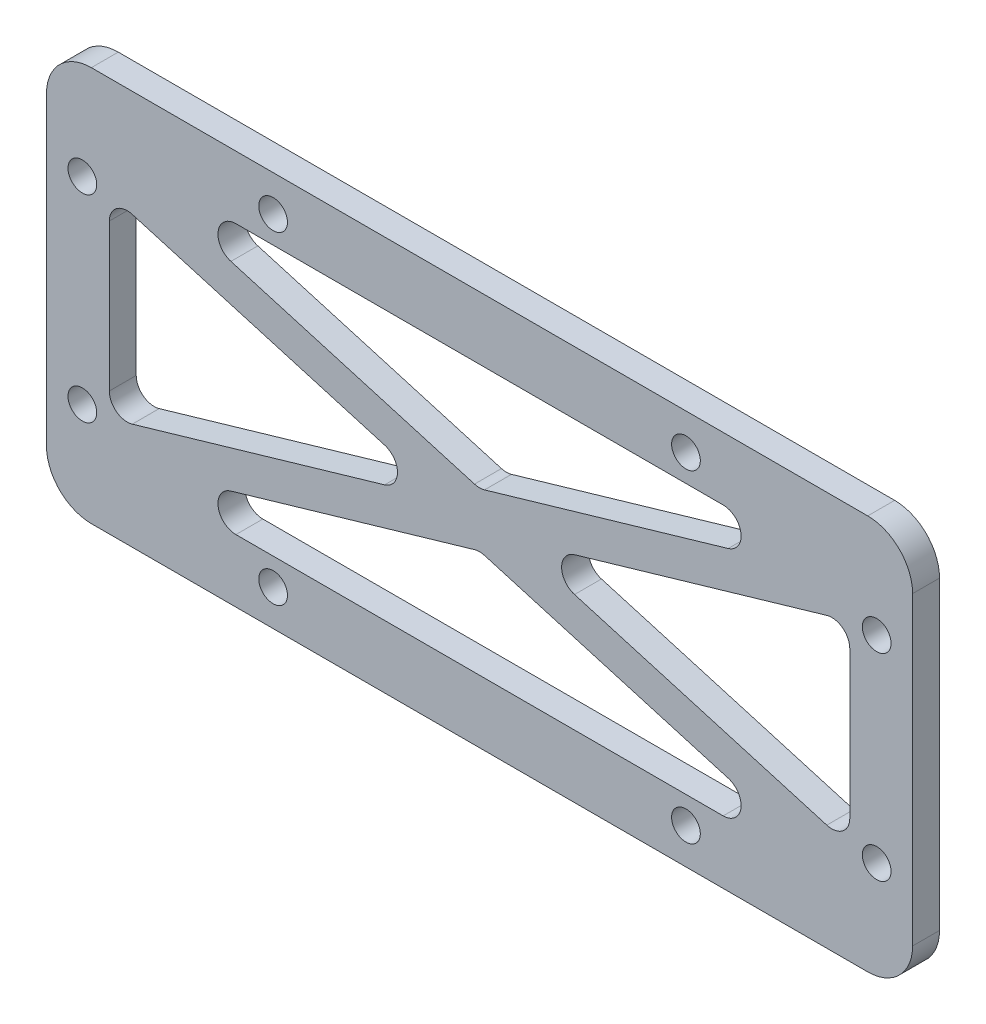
SolidWorks part; units mm, degrees
ref_plane "前视基准面" through (0, 0, 0) normal (0, 0, 1) x (1, 0, 0)
ref_plane "上视基准面" through (0, 0, 0) normal (0, 1, 0) x (1, 0, 0)
ref_plane "右视基准面" through (0, 0, 0) normal (1, 0, 0) x (0, 0, -1)
sketch "草图1" plane through (0, 0, 0) normal (0, 0, 1) x (1, 0, 0)
  line L0 (27.1114, 11.2135) -> (-27.1114, 11.2135)
  line L1 (-2.6024, -11.2135) -> (2.6024, -11.2135)
  line L3 (-48.2508, -22) -> (48.2508, -22)
  line L4 (-48.2508, -22) -> (-48.2508, 22)
  line L5 (-48.2508, 22) -> (48.2508, 22)
  line L6 (48.2508, -22) -> (48.2508, 22)
  line L7 (-48.2508, -22) -> (48.2508, 22) construction
  line L8 (-48.2508, 22) -> (48.2508, -22) construction
  arc A0 (-39.034, 5.5252) -> (-37.1301, -9.2259) centre (-36.2508, -1.614) ccw
  arc A1 (-37.1301, -9.2259) -> (-2.6024, -11.2135) centre (-2.6024, 289.6827) ccw
  arc A2 (2.6024, -11.2135) -> (37.1301, -9.2259) centre (2.6024, 289.6827) ccw
  arc A3 (37.1301, -9.2259) -> (39.034, 5.5252) centre (36.2508, -1.614) ccw
  parabola Q0
  spline S0 degree 3 poles (-31.8155, 7.781) (-32.3574, 7.3189) (-32.9593, 7.044) (-33.6058, 6.8537) knots 0.815552 0.815552 0.815552 0.815552 0.891439 0.891439 0.891439 0.891439
  spline S1 degree 3 poles (-33.6058, 6.8537) (-34.5724, 6.5693) (-36.3536, 6.4101) (-38.2708, 5.8228) (-39.034, 5.5252) knots 0.626058 0.626058 0.626058 0.626058 0.739504 0.815552 0.815552 0.815552 0.815552
  spline S2 degree 3 poles (39.034, 5.5252) (38.2708, 5.8228) (36.3536, 6.4101) (34.5724, 6.5693) (33.6058, 6.8537) knots 0.626058 0.626058 0.626058 0.626058 0.702106 0.815552 0.815552 0.815552 0.815552
  spline S3 degree 3 poles (33.6058, 6.8537) (32.9593, 7.044) (32.3574, 7.3189) (31.8155, 7.781) knots 0.815552 0.815552 0.815552 0.815552 0.891439 0.891439 0.891439 0.891439
  spline S4 degree 3 poles (31.8155, 7.781) (30.9689, 8.2625) (30.1499, 8.7924) (28.5802, 9.9391) (27.8295, 10.5556) (27.1114, 11.2135) knots 0 0 0 0 0.5 0.5 1 1 1 1
  point P18 (0, 0)
  dimension "D1" = 12
  dimension "D2" = 22
extrude "凸台-拉伸1" add sketch "草图1" along normal blind 3 contours L4 L5 L6 L3
sketch "草图2" plane through (0, 0, 3) normal (0, 0, 1) x (1, 0, 0)
  line L2 (-44.2508, -11) -> (44.2508, -11) construction
  line L3 (-44.2508, -11) -> (-44.2508, 11) construction
  line L4 (-44.2508, 11) -> (44.2508, 11) construction
  line L5 (44.2508, -11) -> (44.2508, 11) construction
  line L6 (-44.2508, -11) -> (44.2508, 11) construction
  line L7 (-44.2508, 11) -> (44.2508, -11) construction
  circle A0 centre (44.2508, 11) radius 1.6
  circle A1 centre (44.2508, -11) radius 1.6
  circle A2 centre (-44.2508, -11) radius 1.6
  circle A3 centre (-44.2508, 11) radius 1.6
  point P0 (0, 0)
  point P6 (0, 0)
  dimension "D1" = 88.5016
  dimension "D2" = 22
  dimension "D3" = 3.2
extrude "切除-拉伸1" cut sketch "草图2" against normal through all
sketch "草图3" plane through (0, 0, 3) normal (0, 0, 1) x (1, 0, 0)
  line L0 (-48.2508, 22) -> (48.2508, 22) construction
  line L1 (-23, -18) -> (23, -18) construction
  line L2 (-23, -18) -> (-23, 18) construction
  line L3 (-23, 18) -> (23, 18) construction
  line L4 (23, -18) -> (23, 18) construction
  line L5 (-23, -18) -> (23, 18) construction
  line L6 (-23, 18) -> (23, -18) construction
  circle A0 centre (-23, 18) radius 1.6
  circle A1 centre (23, 18) radius 1.6
  circle A2 centre (23, -18) radius 1.6
  circle A3 centre (-23, -18) radius 1.6
  point P0 (0, 0)
  dimension "D3" = 3.2
  dimension "D1" = 46
  dimension "D2" = 4
extrude "切除-拉伸2" cut sketch "草图3" against normal through all
fillet "圆角1" radius 5 4 edges at (-48.2508, 22, 1.5) (-48.2508, -22, 1.5) (48.2508, -22, 1.5) (48.2508, 22, 1.5)
sketch "草图4" plane through (0, 0, 3) normal (0, 0, 1) x (1, 0, 0)
  line L0 (0, -22) -> (0, 22) construction
  line L1 (-43.2508, -22) -> (43.2508, -22) construction
  line L2 (-43.2508, 22) -> (43.2508, 22) construction
  line L3 (-48.2508, 0) -> (48.2508, 0) construction
  line L4 (-48.2508, -17) -> (-48.2508, 17) construction
  line L5 (48.2508, -17) -> (48.2508, 17) construction
  line L6 (-48.2508, 22) -> (48.2508, -22) construction
  line L7 (-48.2508, -22) -> (48.2508, 22) construction
  line L8 (-41.2508, 10.8648) -> (-41.2508, -10.8648)
  line L9 (-41.2508, -10.8648) -> (-4, 0)
  line L10 (-4, 0) -> (-41.2508, 10.8648)
  line L11 (-41.1429, 15) -> (0, 3)
  line L12 (0, 3) -> (41.1429, 15)
  line L13 (41.1429, 15) -> (-41.1429, 15)
  line L14 (0, -3) -> (41.1429, -15)
  line L15 (41.1429, -15) -> (-41.1429, -15)
  line L16 (-41.1429, -15) -> (0, -3)
  line L17 (41.2508, -10.8648) -> (4, 0)
  line L18 (4, 0) -> (41.2508, 10.8648)
  line L19 (41.2508, 10.8648) -> (41.2508, -10.8648)
  circle A0 centre (-44.2508, 11) radius 1.6 construction
  circle A1 centre (23, 18) radius 1.6 construction
  point P26 (-5.9941, 0)
  point P27 (-3.5965, 0)
  dimension "D1" = 3
  dimension "D2" = 3
  dimension "D3" = 4
  dimension "D4" = 6
  dimension "D5" = 8
extrude "切除-拉伸3" cut sketch "草图4" against normal through all
fillet "圆角2" radius 2 12 edges at (-41.2508, -10.8648, 1.5) (-41.1429, -15, 1.5) (41.1429, -15, 1.5) (-4, 0, 1.5) (0, -3, 1.5) (4, 0, 1.5) (41.2508, -10.8648, 1.5) (41.2508, 10.8648, 1.5) (0, 3, 1.5) (41.1429, 15, 1.5) (-41.2508, 10.8648, 1.5) (-41.1429, 15, 1.5)
